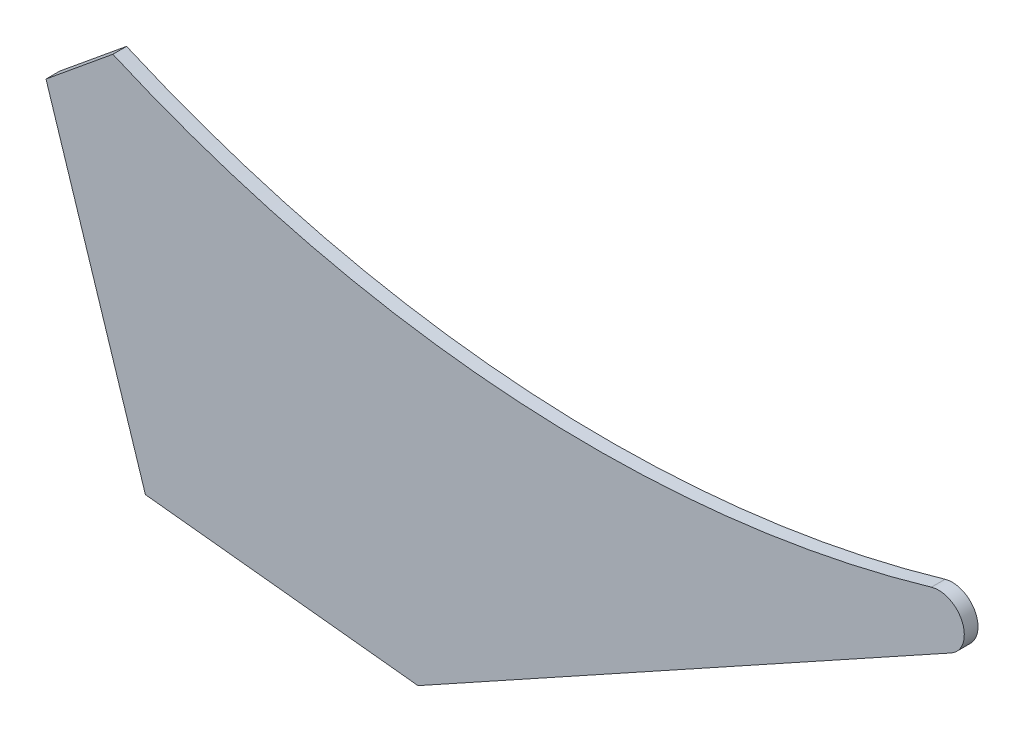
SolidWorks part; units mm, degrees
ref_plane "前视基准面" through (0, 0, 0) normal (0, 0, 1) x (1, 0, 0)
ref_plane "上视基准面" through (0, 0, 0) normal (0, 1, 0) x (1, 0, 0)
ref_plane "右视基准面" through (0, 0, 0) normal (1, 0, 0) x (0, 0, -1)
sketch "草图1" plane through (0, 0, 0) normal (0, 0, 1) x (1, 0, 0)
  line L0 (0, 0) -> (-159, 17)
  line L1 (-159, 17) -> (-217, 198)
  line L2 (-217, 198) -> (-178, 230)
  line L3 (0, 0) -> (311, 172)
  arc A0 (-178, 230) -> (299.5367, 199.5252) centre (102.8, 873.3936) ccw
  arc A1 (311, 172) -> (299.5367, 199.5252) centre (303.7405, 185.1263) ccw
  dimension "D7" = 702
  dimension "D8" = 15
  dimension "D1" = 159
  dimension "D2" = 17
  dimension "D3" = 58
  dimension "D4" = 181
  dimension "D5" = 39
  dimension "D6" = 32
  dimension "D9" = 172
  dimension "D10" = 311
extrude "拉伸1" add sketch "草图1" along normal blind 8
